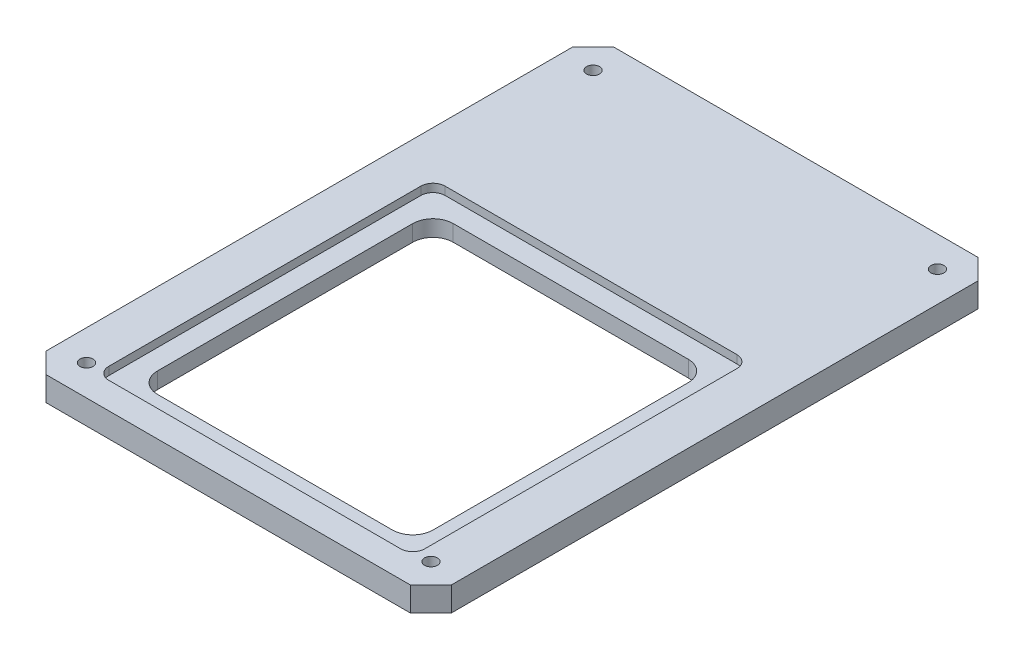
SolidWorks part; units mm, degrees
ref_plane "Plan de face" through (0, 0, 0) normal (0, 0, 1) x (1, 0, 0)
ref_plane "Plan de dessus" through (0, 0, 0) normal (0, 1, 0) x (1, 0, 0)
ref_plane "Plan de droite" through (0, 0, 0) normal (1, 0, 0) x (0, 0, -1)
sketch "Esquisse1" plane through (0, 0, 0) normal (0, 1, 0) x (1, 0, 0)
  line L0 (-21.8739, 3) -> (122.288, 3) construction
  line L1 (-2.5, -19.0751) -> (-2.5, 147.324) construction
  line L2 (97.5, -17.4189) -> (97.5, 147.324) construction
  line L3 (108.5425, 143) -> (-15.8785, 143) construction
  line L4 (-53.7499, 73) -> (113.7067, 73) construction
  line L5 (47.5, 178.7706) -> (47.5, -51.7751) construction
  line L6 (18.5, 82.5) -> (18.5, 19.5) construction
  line L7 (0, 5.5) -> (95, 5.5) construction
  line L8 (0, 5.5) -> (0, 140.5) construction
  line L9 (0, 140.5) -> (95, 140.5) construction
  line L10 (95, 5.5) -> (95, 140.5) construction
  line L11 (-4.2438, 9.7438) -> (2.5284, 2.9716) construction
  line L12 (-2.5, 8.0225) -> (2.5284, 2.9716)
  line L13 (8.1985, 10.5) -> (-1.0093, 10.5) construction
  line L14 (5, 13.5757) -> (5, 4.5577) construction
  line L15 (18.5, 82.5) -> (78.8285, 82.5) construction
  line L16 (97.5, 8.0225) -> (92.4716, 2.9716)
  line L17 (-2.5, 137.9775) -> (2.5284, 143.0284)
  line L18 (11.1751, 87.5) -> (84.4411, 87.5) construction
  line L19 (81.5, 93.2306) -> (81.5, 12.5035) construction
  line L20 (85.5545, 14.5) -> (11.1751, 14.5) construction
  line L21 (18.5, 19.5) -> (76.5, 19.5) construction
  line L22 (76.5, 82.5) -> (76.5, 19.5) construction
  line L23 (13.5, 93.8987) -> (13.5, 12.5035) construction
  line L24 (97.5, 137.9775) -> (92.4716, 143.0284)
  line L25 (18.5, 87.5) -> (76.5, 87.5)
  line L26 (13.5, 82.5) -> (13.5, 19.5)
  line L27 (18.5, 14.5) -> (76.5, 14.5)
  line L28 (81.5, 82.5) -> (81.5, 19.5)
  line L29 (2.5284, 143.0284) -> (92.4716, 143.0284)
  line L30 (97.5, 137.9775) -> (97.5, 8.0225)
  line L31 (92.4716, 2.9716) -> (2.5284, 2.9716)
  line L32 (-2.5, 8.0225) -> (-2.5, 137.9775)
  circle A0 centre (5, 10.5) radius 1.6
  circle A1 centre (90, 10.5) radius 1.6
  circle A2 centre (90, 135.5) radius 1.6
  circle A3 centre (5, 135.5) radius 1.6
  arc A4 (18.5, 87.5) -> (13.5, 82.5) centre (18.5, 82.5) ccw
  arc A5 (76.5, 87.5) -> (81.5, 82.5) centre (76.5, 82.5) cw
  arc A6 (13.5, 19.5) -> (18.5, 14.5) centre (18.5, 19.5) ccw
  arc A7 (76.5, 14.5) -> (81.5, 19.5) centre (76.5, 19.5) ccw
  dimension "D5" = 58
  dimension "D11" = 5
  dimension "D2" = 77
  dimension "D3" = 18.5
  dimension "D4" = 18.5
  dimension "D6" = 63
  dimension "D7" = 5
  dimension "D8" = 5
  dimension "D9" = 5
  dimension "D10" = 5
  dimension "D12" = 135
  dimension "D13" = 67.5
  dimension "D14" = 45
  dimension "D15" = 5
  dimension "D16" = 5
extrude "Extrusion1" add sketch "Esquisse1" along normal blind 6
sketch "Esquisse2" plane through (0, 6, 0) normal (0, 1, 0) x (-1, 0, 0)
  line L0 (-8.5, -5.1243) -> (-8.5, -108.048) construction
  line L1 (-4.5313, -92.5) -> (-90.9443, -92.5) construction
  line L2 (-86.5, -102.4985) -> (-86.5, -5.1243) construction
  line L3 (-5.9583, -9.5) -> (-88.7245, -9.5) construction
  line L4 (-90.9443, -87.5) -> (37.3274, -87.5) construction
  line L5 (-13.5, -104.2426) -> (-13.5, -1.6569) construction
  line L6 (-3.1043, -14.5) -> (-136.767, -14.5) construction
  line L7 (-81.5, -1.6569) -> (-81.5, -104.2426) construction
  line L8 (-10.1473, -13.1) -> (-13.1636, -13.1) construction
  line L9 (-11.5, -92.5) -> (-83.5, -92.5)
  line L10 (-8.5, -89.5) -> (-8.5, -12.5)
  line L11 (-11.5, -9.5) -> (-83.5, -9.5)
  line L12 (-86.5, -89.5) -> (-86.5, -12.5)
  line L13 (-12.1, -14.0407) -> (-12.1, -11.3176) construction
  arc A0 (-11.5, -92.5) -> (-8.5, -89.5) centre (-11.5, -89.5) ccw
  arc A1 (-83.5, -92.5) -> (-86.5, -89.5) centre (-83.5, -89.5) cw
  arc A2 (-83.5, -9.5) -> (-86.5, -12.5) centre (-83.5, -12.5) ccw
  arc A3 (-8.5, -12.5) -> (-11.5, -9.5) centre (-11.5, -12.5) ccw
  dimension "D5" = 3
  dimension "D1" = 5
  dimension "D2" = 5
  dimension "D3" = 5
  dimension "D4" = 5
  dimension "D6" = 3.6
  dimension "D7" = 3.6
extrude "Enlèv. mat.-Extru.1" cut sketch "Esquisse2" against normal blind 2
